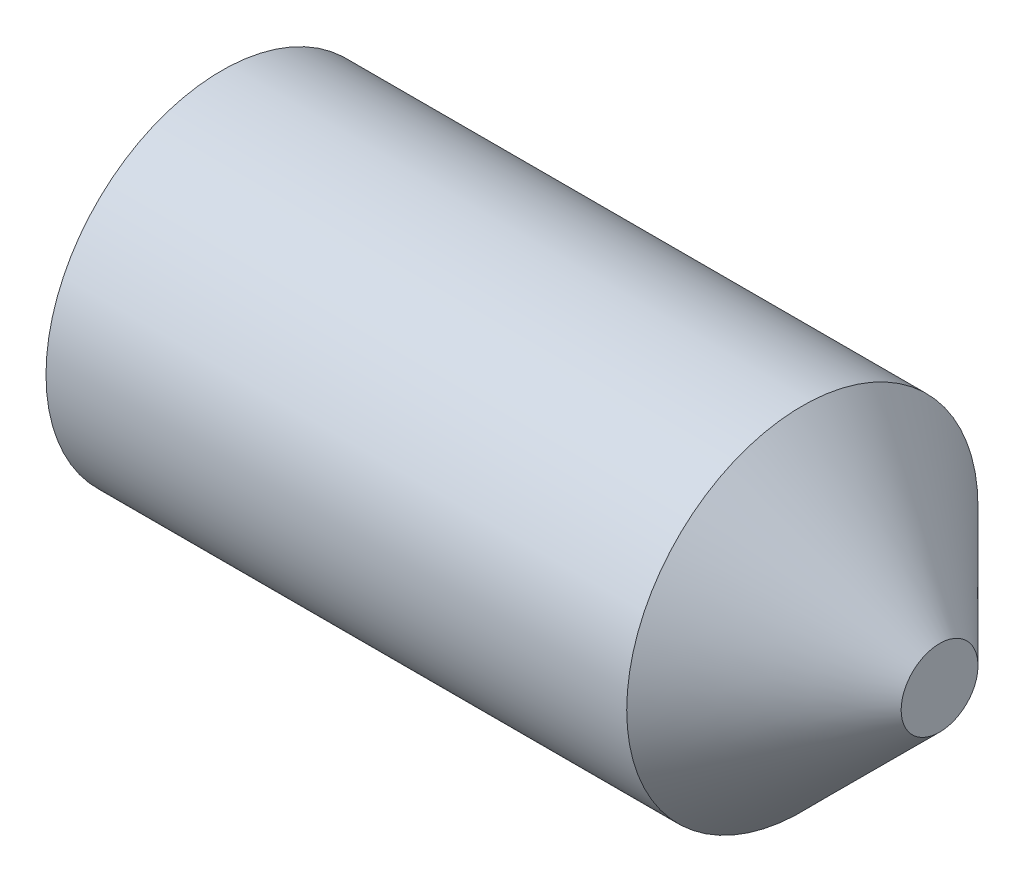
SolidWorks part; units mm, degrees
ref_plane "Plane1" through (0, 0, 0) normal (0, 0, 1) x (1, 0, 0)
ref_plane "Plane2" through (0, 0, 0) normal (0, 1, 0) x (1, 0, 0)
ref_plane "Plane3" through (0, 0, 0) normal (1, 0, 0) x (0, 0, -1)
sketch "BodySke" plane through (0, 0, 0) normal (0, 0, 1) x (1, 0, 0)
  line L0 (0, 0) -> (0, 10.352)
  line L1 (0, 10.352) -> (0.9515, 12)
  line L2 (0.9515, 12) -> (40.625, 12)
  line L3 (40.625, 12) -> (50, 2.625)
  line L4 (50, 0) -> (0, 0)
  line L5 (-12.7, 0) -> (88.9, 0) construction
  line L6 (50, 2.625) -> (50, 0)
  line L7 (50, 2.625) -> (50, 12.15) construction
  line L8 (0, -10.352) -> (0.9515, -12) construction
  line L9 (3, 15.875) -> (3, -3.175) construction
  line L10 (40.625, -12) -> (50, -2.625) construction
  dimension "Cone_ang" = 90
  dimension "Length" = 50
  dimension "Diameter" = 24
  dimension "Drive_ch_ang" = 60
  dimension "Minor_dia" = 20.704
  dimension "Tip_dia" = 5.25
  dimension "Advance" = 3
revolve "BaseBody" add sketch "BodySke" angle 360 about L5
sketch "Sketch2" plane through (0, 0, 0) normal (-1, 0, 0) x (0, 0, 1)
  line L0 (3.4641, 6) -> (-3.4641, 6)
  line L1 (-3.4641, 6) -> (-6.9282, 0)
  line L2 (3.4641, 6) -> (6.9282, 0)
  line L3 (3.4641, -6) -> (6.9282, 0)
  line L4 (3.4641, -6) -> (-3.4641, -6)
  line L5 (-3.4641, -6) -> (-6.9282, 0)
  dimension "Hex_size" = 12
  dimension "D2" = 6
  dimension "D3" = 6
extrude "Hex" cut sketch "Sketch2" against normal blind 15
sketch "ThdSchSke" [suppressed] plane through (0, 0, 0) normal (0, 0, 1) x (1, 0, 0)
  line L0 (0.9515, -10.352) -> (-0.2025, -12)
  line L1 (0.9515, -10.352) -> (2.1054, -12)
  line L2 (2.1054, -12) -> (2.1054, -15)
  line L3 (-3.175, 0) -> (5.1513, 0) construction
  line L5 (2.1054, -15) -> (-0.2025, -15)
  line L6 (-0.2025, -15) -> (-0.2025, -12)
  line L8 (0.9515, 12) -> (0.9515, -12) construction
  dimension "Thread_minor" = 20.704
  dimension "Diameter" = 24
  dimension "SideAngle" = 55
  dimension "VeeAngle" = 70
  dimension "Overcut" = 30
revolve "ThreadSchematic" [suppressed] cut sketch "ThdSchSke" angle 360 about L3
pattern_linear "ThdSchPat" [suppressed]
equation "\"D2@Sketch2\" = \"Hex_size@Sketch2\" / 2"
equation "\"D3@Sketch2\" = \"Hex_size@Sketch2\" / 2"
equation "\"Thread_minor@ThreadCosmetic\" = \"Minor_dia@BodySke\""
equation "\"Thread_minor@ThdSchSke\" = \"Thread_minor@ThreadCosmetic\""
equation "\"Diameter@ThdSchSke\" = \"Diameter@BodySke\""
equation "\"Overcut@ThdSchSke\" = \"Diameter@BodySke\" * 1.25"
equation "\"Num_threads@ThdSchPat\" = int( (\"Length@BodySke\" - ( ( ( \"Diameter@BodySke\" - \"Minor_dia@BodySke\" ) * 0.5 ) / tan( \"Drive_ch_ang@BodySke\" * 0.017453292 ) ) - ( ( ( \"Diameter@BodySke\" - \"Tip_dia@BodySk"
equation "\"Advance@ThdSchPat\" = (\"Length@BodySke\" - ( ( ( \"Diameter@BodySke\" - \"Minor_dia@BodySke\" ) * 0.5 ) / tan( \"Drive_ch_ang@BodySke\" * 0.017453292 ) ) - ( ( ( \"Diameter@BodySke\" - \"Tip_dia@BodySke\" ) * 0."
equation "' \"Num_threads@ThdSchPat\" = \"Num_threads@ThdSchPat\" - sgn( \"Num_threads@ThdSchPat\" - 1) '---chamfered tips only---"
